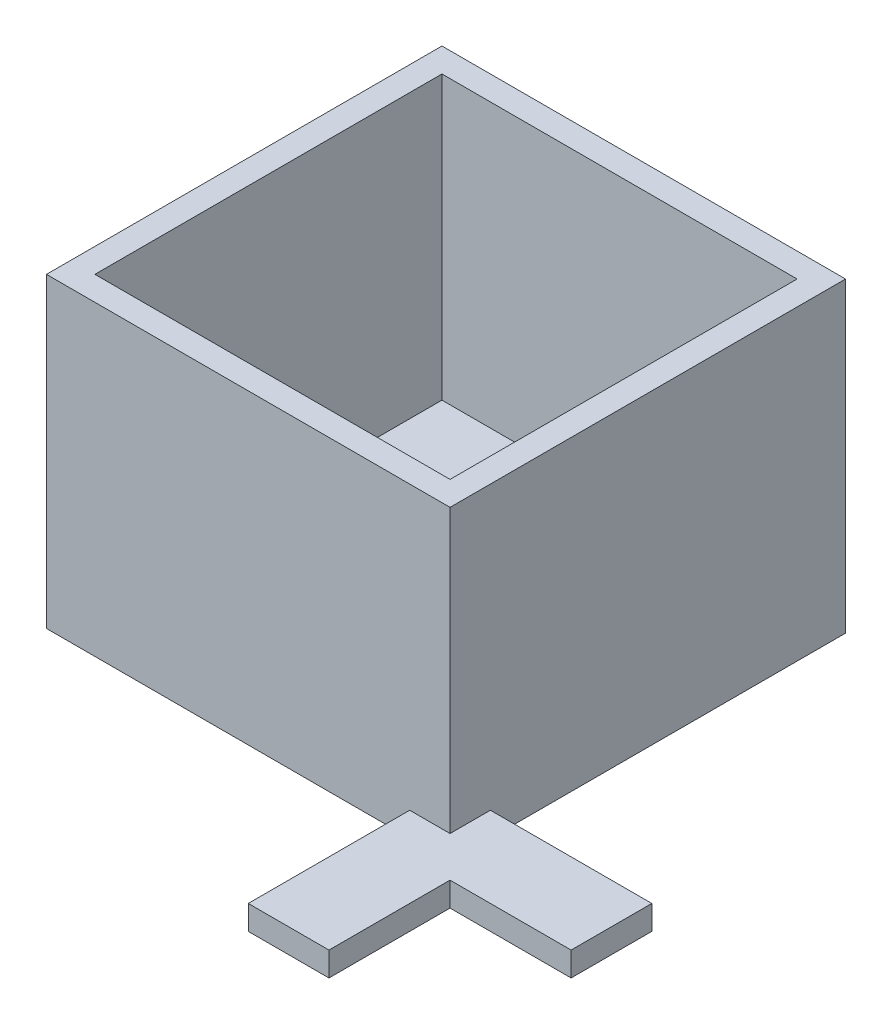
SolidWorks part; units mm, degrees
ref_plane "Front Plane" through (0, 0, 0) normal (0, 0, 1) x (1, 0, 0)
ref_plane "Top Plane" through (0, 0, 0) normal (0, 1, 0) x (1, 0, 0)
ref_plane "Right Plane" through (0, 0, 0) normal (1, 0, 0) x (0, 0, -1)
sketch "Sketch2" plane through (0, 0, 0) normal (0, 1, 0) x (1, 0, 0)
  line L1 (0, 0) -> (50, 0)
  line L2 (0, 0) -> (0, 49)
  line L3 (0, 49) -> (50, 49)
  line L4 (50, 0) -> (50, 49)
  dimension "D1" = 50
  dimension "D2" = 49
extrude "Boss-Extrude1" add sketch "Sketch2" along normal blind 38
sketch "Sketch3" plane through (0, 38, 0) normal (0, 1, 0) x (1, 0, 0)
  line L8 (3, 46) -> (3, 3)
  line L9 (3, 3) -> (47, 3)
  line L10 (47, 3) -> (47, 46)
  line L11 (47, 46) -> (3, 46)
  line L12 (3, 46) -> (3, 3)
  line L13 (3, 3) -> (47, 3)
  line L14 (47, 3) -> (47, 46)
  line L15 (47, 46) -> (3, 46)
  dimension "D1" = 3
extrude "Cut-Extrude1" cut sketch "Sketch3" against normal offset from surface (35 mm away) 3
sketch "Sketch4" plane through (0, 0, 0) normal (0, -1, 0) x (1, 0, 0)
  line L0 (50, 0) -> (50, 5) construction
  line L1 (50, 5) -> (55, 5) construction
  line L2 (50, 0) -> (45, 0)
  line L3 (0, 0) -> (50, 0) construction
  line L4 (45, 0) -> (45, 20)
  line L5 (45, 20) -> (55, 20)
  line L6 (55, 20) -> (55, 5)
  line L7 (55, 5) -> (70, 5)
  line L8 (70, 5) -> (70, -5)
  line L9 (70, -5) -> (50, -5)
  line L10 (50, 0) -> (50, -49) construction
  line L11 (50, -5) -> (50, 0)
  dimension "D1" = 5
  dimension "D2" = 5
  dimension "D3" = 5
  dimension "D4" = 20
  dimension "D5" = 20
  dimension "D6" = 5
extrude "Boss-Extrude2" add sketch "Sketch4" against normal blind 3
sketch "Sketch5" plane through (0, 0, 0) normal (0, -1, 0) x (1, 0, 0)
  line L1 (55, 5) -> (270.9, 5)
  line L2 (55, 5) -> (55, 284.4)
  line L3 (55, 284.4) -> (270.9, 284.4)
  line L4 (270.9, 5) -> (270.9, 284.4)
  dimension "D1" = 215.9
  dimension "D2" = 279.4
